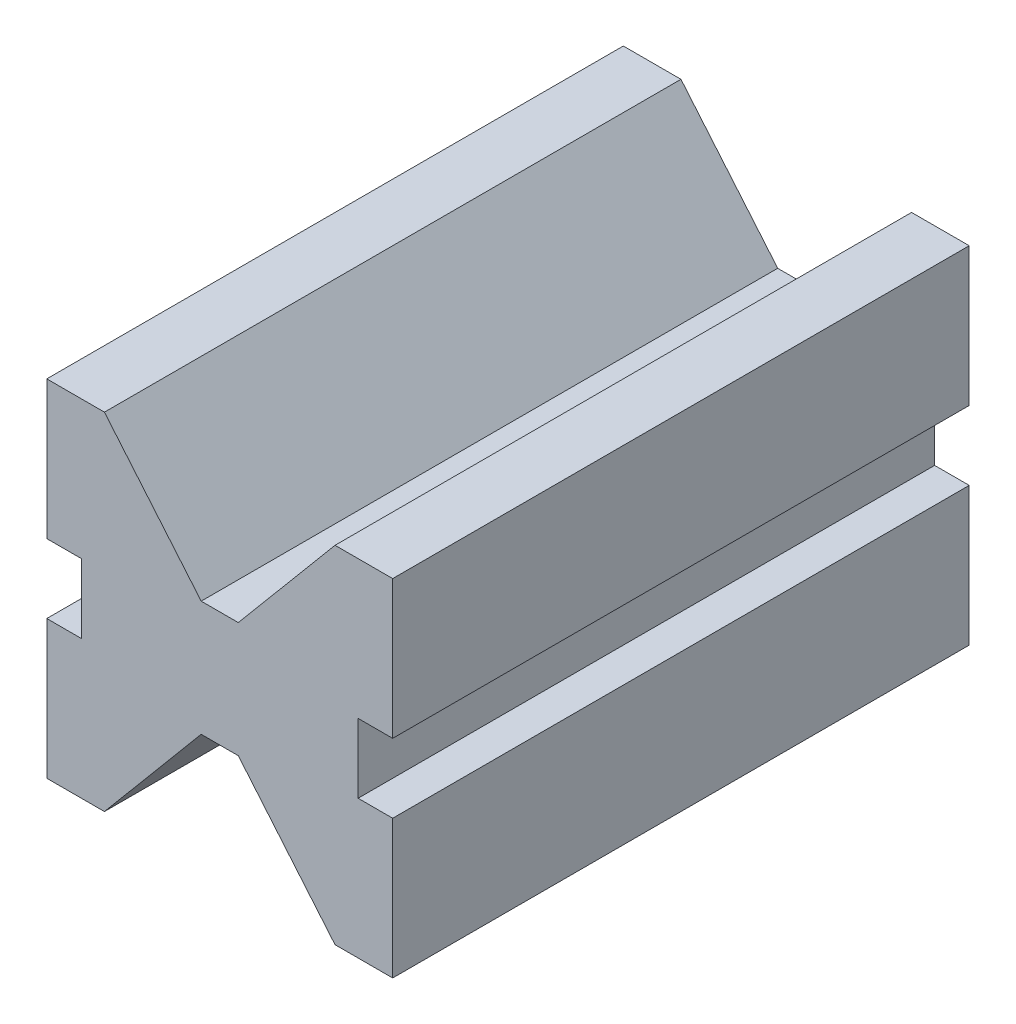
SolidWorks part; units mm, degrees
ref_plane "Front Plane" through (0, 0, 0) normal (0, 0, 1) x (1, 0, 0)
ref_plane "Top Plane" through (0, 0, 0) normal (0, 1, 0) x (1, 0, 0)
ref_plane "Right Plane" through (0, 0, 0) normal (1, 0, 0) x (0, 0, -1)
sketch "Sketch1" plane through (0, 0, 0) normal (0, 0, 1) x (1, 0, 0)
  line L0 (0, 0) -> (0, -19873.366) construction
  line L1 (0, 0) -> (3.218, 0)
  line L2 (3.218, 0) -> (20, -20)
  line L3 (20, -20) -> (30, -20)
  line L4 (30, -20) -> (30, 4)
  line L5 (30, 4) -> (24, 4)
  line L6 (24, 4) -> (24, 16)
  line L7 (24, 16) -> (30, 16)
  line L8 (30, 16) -> (30, 40)
  line L9 (30, 40) -> (20, 40)
  line L10 (20, 40) -> (3.218, 20)
  line L11 (3.218, 20) -> (0, 20)
  line L12 (0, 20) -> (0, 0)
  dimension "D1" = 24
  dimension "D2" = 60
  dimension "D3" = 24
  dimension "D4" = 6
  dimension "D5" = 20
  dimension "D6" = 20
  dimension "D7" = 50
  dimension "D8" = 50
  dimension "D9" = 20
  dimension "D10" = 30
  dimension "D11" = 20
  dimension "D12" = 30
extrude "Boss-Extrude1" add sketch "Sketch1" along normal blind 100
mirror "Mirror1" about plane through (0, 20, 100) normal (1, 0, 0) of "Boss-Extrude1"
